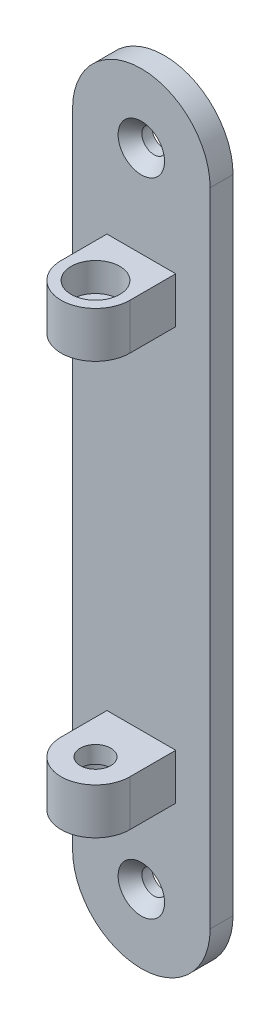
SolidWorks part; units mm, degrees
ref_plane "Front Plane" through (0, 0, 0) normal (0, 0, 1) x (1, 0, 0)
ref_plane "Top Plane" through (0, 0, 0) normal (0, 1, 0) x (1, 0, 0)
ref_plane "Right Plane" through (0, 0, 0) normal (1, 0, 0) x (0, 0, -1)
sketch "Sketch40" plane through (0, 0, 0) normal (0, 0, 1) x (1, 0, 0)
  line L0 (0, 0) -> (49.1847, 0) construction
  line L1 (0, -88.9) -> (0, 88.9)
  line L2 (38.1, 88.9) -> (38.1, -88.9)
  arc A0 (0, 88.9) -> (38.1, 88.9) centre (19.05, 88.9) cw
  arc A1 (0, -88.9) -> (38.1, -88.9) centre (19.05, -88.9) ccw
  point P10 (38.1, 0)
  dimension "D1" = 19.05
  dimension "D2" = 88.9
extrude "Extrude13" add sketch "Sketch40" along normal blind 6.35
hole_wizard "CSK for 1/4 Flat Head Machine Screw6" positions "Sketch42" profile "Sketch41" countersink size "1/4" standard "Ansi Inch"
sketch "Sketch42" plane through (0, 0, 6.35) normal (0, 0, 1) x (1, 0, 0)
  arc A0 (38.1, 88.9) -> (0, 88.9) centre (19.05, 88.9) ccw construction
  point P0 (19.05, 88.9)
sketch "Sketch41" plane through (19.05, 88.9, 6.35) normal (1, 0, 0) x (0, -1, 0)
  line L0 (0, 0) -> (0, 6.35)
  line L1 (0, 6.35) -> (3.3782, 6.35)
  line L2 (3.3782, 6.35) -> (3.3782, 3.5209)
  line L3 (3.3782, 3.5209) -> (6.4389, 0)
  line L5 (6.4389, 0) -> (0, 0)
  line L6 (-3.3782, 3.5209) -> (-6.4389, 0) construction
  line L11 (0, -6.35) -> (0, 107.95) construction
  dimension "Thru Hole Dia." = 6.7564
  dimension "Thru Hole Depth" = 6.35
  dimension "Near C'Sink Dia." = 12.8778
  dimension "Near C'Sink Angle" = 82
sketch "Sketch43" plane through (0, 0, 6.35) normal (0, 0, 1) x (1, 0, 0)
  line L0 (19.05, 88.9) -> (19.05, 35.7379) construction
  line L1 (9.525, 63.5) -> (28.575, 63.5)
  line L2 (9.525, 63.5) -> (9.525, 50.8)
  line L3 (9.525, 50.8) -> (28.575, 50.8)
  line L4 (28.575, 63.5) -> (28.575, 50.8)
  dimension "D1" = 12.7
  dimension "D2" = 19.05
  dimension "D3" = 50.8
extrude "Extrude14" add sketch "Sketch43" along normal blind 12.7
sketch "Sketch44" plane through (0, 63.5, 0) normal (0, 1, 0) x (-1, 0, 0)
  line L0 (-9.525, 19.05) -> (-28.575, 19.05)
  arc A0 (-28.575, 19.05) -> (-9.525, 19.05) centre (-19.05, 19.05) cw
extrude "Extrude15" add sketch "Sketch44" against normal up to surface (12.7 mm away)
hole_wizard "CBORE for 5/16 Socket Head Cap Screw4" positions "Sketch46" profile "Sketch45" counterbore size "5/16" standard "Ansi Inch"
sketch "Sketch46" plane through (0, 63.5, 0) normal (0, 1, 0) x (-1, 0, 0)
  arc A0 (-9.525, 19.05) -> (-28.575, 19.05) centre (-19.05, 19.05) ccw construction
  point P0 (-19.05, 19.05)
sketch "Sketch45" plane through (19.05, 63.5, 19.05) normal (1, 0, 0) x (0, 0, 1)
  line L0 (0, 0) -> (0, 15.2335)
  line L1 (0, 15.2335) -> (4.2164, 12.7)
  line L2 (4.2164, 12.7) -> (4.2164, 7.9375)
  line L3 (4.2164, 7.9375) -> (6.7475, 7.9375)
  line L4 (6.7475, 7.9375) -> (6.7475, 0)
  line L5 (6.7475, 0) -> (0, 0)
  line L10 (0, 15.2335) -> (-4.2164, 12.7) construction
  line L11 (0, -6.35) -> (0, 107.95) construction
  dimension "Hole Dia." = 8.4328
  dimension "Hole Depth" = 12.7
  dimension "C'Bore Dia." = 13.495
  dimension "C'Bore Depth" = 7.9375
  dimension "Drill Angle" = 118
mirror "Mirror4" about plane through (0, 0, 0) normal (0, 1, 0) of "CBORE for 5/16 Socket Head Cap Screw4", "Extrude14", "Extrude15", "CSK for 1/4 Flat Head Machine Screw6"
